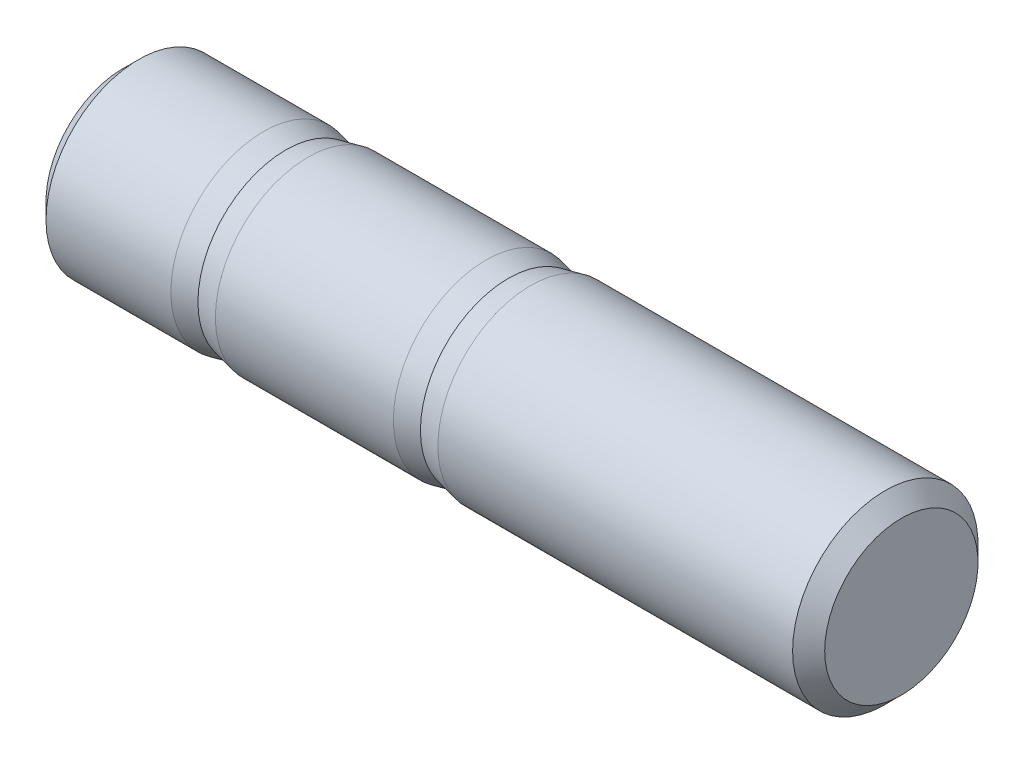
SolidWorks part; units mm, degrees
ref_plane "Front" through (0, 0, 0) normal (0, 0, 1) x (1, 0, 0)
ref_plane "Top" through (0, 0, 0) normal (0, 1, 0) x (1, 0, 0)
ref_plane "Right" through (0, 0, 0) normal (1, 0, 0) x (0, 0, -1)
sketch "Sketch1" plane through (0, 0, 0) normal (0, 0, 1) x (1, 0, 0)
  line L0 (-1.3108, 0) -> (30.3862, 0) construction
  line L1 (0, 0) -> (0, 2.5)
  line L2 (0, 2.5) -> (3.8, 2.5)
  line L3 (3.8, 2.5) -> (5, 2.24)
  line L4 (5, 2.24) -> (9.8, 2.24)
  line L5 (9.8, 2.24) -> (11, 2.5)
  line L6 (11, 2.5) -> (21, 2.5)
  line L7 (21, 2.5) -> (21, 0)
  line L8 (21, 0) -> (0, 0)
  dimension "X" = 1.2
  dimension "D2" = 1.2
  dimension "bm" = 5
  dimension "b" = 10
  dimension "l" = 16
  dimension "d" = 5
  dimension "ds" = 4.48
revolve "BaseHead" add sketch "Sketch1" angle 360 about L0
chamfer "HeadChamfer" distance 0.433 angle 45 2 edges at (0, 0, 2.5) (21, 0, 2.5)
sketch "Sketch2" plane through (0, 0, 0) normal (0, 0, 1) x (1, 0, 0)
  line L0 (4.9774, 0) -> (31.2107, 0) construction
  line L2 (3.8, 2.24) -> (5, 2.5)
  line L3 (5, 2.5) -> (9.8, 2.5)
  line L4 (9.8, 2.5) -> (11, 2.24)
  line L7 (-1.3108, 0) -> (30.3862, 0) construction
  line L9 (3.8, 2.24) -> (11, 2.24)
  line L10 (11, 2.5) -> (11, -2.5) construction
  line L11 (3.8, 2.5) -> (3.8, -2.5) construction
  dimension "D1" = 1.2
  dimension "D2" = 5
revolve "BaseBody" add sketch "Sketch2" angle 360 about L0
sketch "Sketch3" plane through (0, 0, 0) normal (0, 0, 1) x (1, 0, 0)
  line L0 (20.567, 2.125) -> (20.7835, 2.5)
  line L1 (20.7835, 2.5) -> (20.7835, 3)
  line L2 (20.7835, 3) -> (20.3505, 3)
  line L3 (20.3505, 3) -> (20.3505, 2.5)
  line L4 (20.3505, 2.5) -> (20.567, 2.125)
  line L5 (0, 0) -> (34.9578, 0) construction
  line L6 (20.567, 2.5) -> (20.567, -2.5) construction
  dimension "D1" = 60
  dimension "D2" = 60
  dimension "D3" = 0.433
  dimension "D4" = 0.5
  dimension "D5" = 5
revolve "Cut-Revolve10" [suppressed] cut sketch "Sketch3" angle 360 about L5
pattern_linear "LPattern10" [suppressed] count 19 spacing 0.5196 along (1, 0, 0)
sketch "Sketch4" plane through (0, 0, 0) normal (0, 0, 1) x (1, 0, 0)
  line L0 (0.433, 2.125) -> (0.6495, 2.5)
  line L1 (0.6495, 2.5) -> (0.6495, 3)
  line L2 (0.6495, 3) -> (0.2165, 3)
  line L3 (0.2165, 3) -> (0.2165, 2.5)
  line L4 (0.2165, 2.5) -> (0.433, 2.125)
  line L5 (0, 0) -> (3.2691, 0) construction
  line L6 (0.433, 2.5) -> (0.433, -2.5) construction
  dimension "D1" = 60
  dimension "D2" = 0.433
  dimension "D3" = 0.5
  dimension "D4" = 60
  dimension "D5" = 5
revolve "Cut-Revolve11" [suppressed] cut sketch "Sketch4" angle 360 about L5
pattern_linear "LPattern11" [suppressed] count 7 spacing 0.5196 along (1, 0, 0)
equation "\"D2@Sketch1\" = \"X@Sketch1\""
equation "\"D2@ThreadCosmetic2\" = \"D2@ThreadCosmetic1\""
equation "\"D1@ThreadCosmetic1\" = \"bm@Sketch1\"-\"X@Sketch1\""
equation "\"b@ThreadCosmetic2\" = \"b@Sketch1\""
equation "\"D1@Sketch2\" = \"X@Sketch1\""
equation "\"D2@Sketch2\" = \"d@Sketch1\""
equation "\"D1@HeadChamfer\" =  ( \"d@Sketch1\" - \"D2@ThreadCosmetic1\" )  / 2"
equation "\"D5@Sketch3\" = \"d@Sketch1\""
equation "\"D3@Sketch3\" =  ( \"d@Sketch1\" - \"D2@ThreadCosmetic2\" )  / 2"
equation "\"D3@LPattern10\" = \"D3@Sketch3\" * 1.2"
equation "\"D1@LPattern10\" = \"b@ThreadCosmetic2\" / \"D3@LPattern10\""
equation "\"D5@Sketch4\" = \"d@Sketch1\""
equation "\"D2@Sketch4\" =  ( \"d@Sketch1\" - \"D2@ThreadCosmetic1\" )  / 2"
equation "\"D3@LPattern11\" = \"D2@Sketch4\" * 1.2"
equation "\"D1@LPattern11\" = \"D1@ThreadCosmetic1\" / \"D3@LPattern11\""
